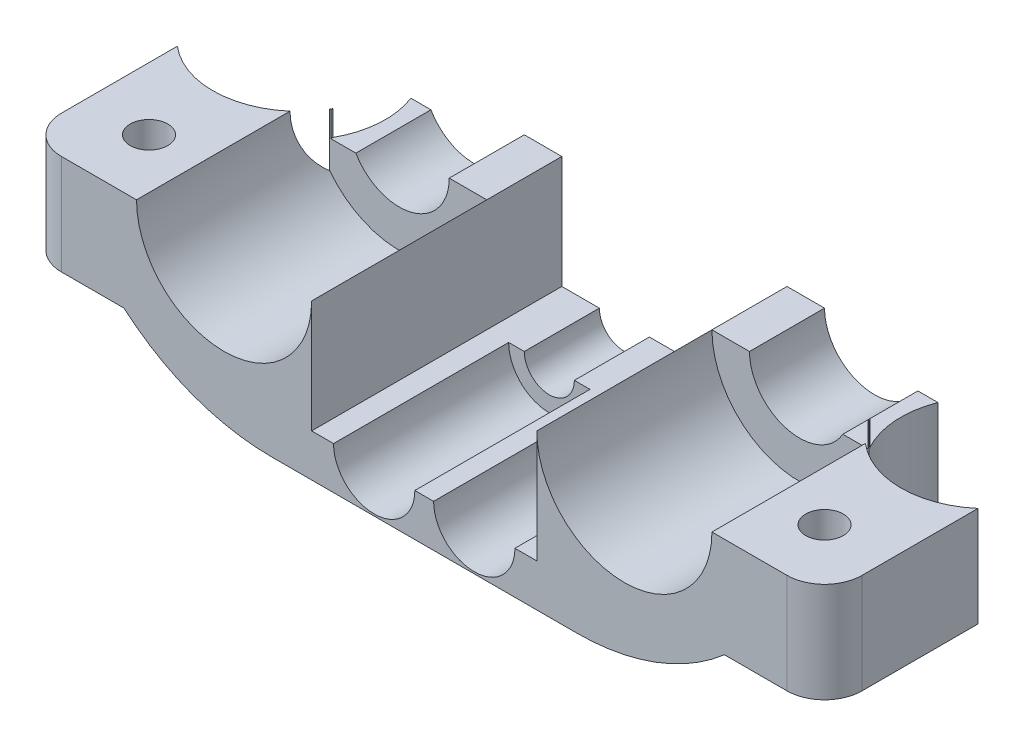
SolidWorks part; units mm, degrees
ref_plane "Plan1" through (0, 0, 0) normal (0, 0, 1) x (1, 0, 0)
ref_plane "Plan2" through (0, 0, 0) normal (0, 1, 0) x (1, 0, 0)
ref_plane "Plan3" through (0, 0, 0) normal (1, 0, 0) x (0, 0, -1)
sketch "Esquisse1" plane through (0, 0, 0) normal (0, 0, 1) x (1, 0, 0)
  line L0 (-32, 12.4) -> (-21.4641, 12.4)
  line L1 (32, 12.4) -> (32, 4.4)
  line L2 (32, 4.4) -> (24, 4.4)
  line L3 (-12.2085, 0) -> (12.2085, 0)
  line L4 (-24, 4.4) -> (-32, 4.4)
  line L5 (-32, 4.4) -> (-32, 12.4)
  line L6 (-9, 12.4) -> (-9, 3.4)
  line L7 (-9, 3.4) -> (-6, 3.4)
  line L8 (9, 3.4) -> (9, 12.4)
  line L9 (9, 12.4) -> (12, 12.4)
  line L10 (-12, 12.4) -> (-9, 12.4)
  line L11 (21.4641, 12.4) -> (32, 12.4)
  line L12 (-2, 3.4) -> (2, 3.4)
  line L13 (6, 3.4) -> (9, 3.4)
  line L14 (-19.4641, 10.4) -> (-21.4641, 10.4)
  line L15 (-21.4641, 10.4) -> (-21.4641, 12.4)
  line L16 (19.4641, 10.4) -> (21.4641, 10.4)
  line L17 (21.4641, 10.4) -> (21.4641, 12.4)
  arc A0 (12.2085, 0) -> (24, 4.4) centre (12.2085, 18) ccw
  arc A1 (-12.2085, 0) -> (-24, 4.4) centre (-12.2085, 18) cw
  arc A2 (-19.4641, 10.4) -> (-12, 12.4) centre (-16, 12.4) ccw
  arc A3 (12, 12.4) -> (19.4641, 10.4) centre (16, 12.4) ccw
  arc A4 (-6, 3.4) -> (-2, 3.4) centre (-4, 3.4) ccw
  arc A5 (2, 3.4) -> (6, 3.4) centre (4, 3.4) ccw
  dimension "D3" = 2
  dimension "D4" = 4
  dimension "D14" = 18
  dimension "D1" = 8
  dimension "D2" = 12.4
  dimension "D5" = 8
  dimension "D6" = 18
  dimension "D7" = 8
  dimension "D8" = 5
  dimension "D9" = 64
  dimension "D10" = 23
  dimension "D11" = 2
  dimension "D12" = 32
  dimension "D13" = 16
  dimension "D15" = 2
extrude "Base-Extrusion" add sketch "Esquisse1" along normal blind 20
sketch "Esquisse2" plane through (0, 4.4, 0) normal (0, -1, 0) x (1, 0, 0)
  line L0 (24, 20) -> (32, 20) construction
  line L1 (24, 20) -> (12.2085, 20) construction
  circle A0 centre (-27.5, 2.5) radius 6.9
  circle A1 centre (27.5, 2.5) radius 6.9
  circle A2 centre (27, 15) radius 1.5
  circle A3 centre (-27, 15) radius 1.5
  dimension "D1" = 3
  dimension "D2" = 13.8
  dimension "D3" = 54
  dimension "D4" = 27
  dimension "D5" = 5
  dimension "D6" = 55
  dimension "D7" = 27.5
  dimension "D8" = 17.5
extrude "Enlèv. mat.-Extru.1" cut sketch "Esquisse2" against normal mid plane 20
sketch "Esquisse3" plane through (0, 4.4, 0) normal (0, -1, 0) x (1, 0, 0)
  circle A0 centre (-27, 15) radius 3.5
  circle A1 centre (27, 15) radius 3.5
  dimension "D1" = 7
extrude "Enlèv. mat.-Extru.2" cut sketch "Esquisse3" against normal blind 3
sketch "Esquisse4" plane through (0, 0, 20) normal (0, 0, 1) x (1, 0, 0)
  circle A0 centre (-16, 12.4) radius 7
  circle A1 centre (16, 12.4) radius 7
  circle A2 centre (-4, 3.4) radius 3.25
  circle A3 centre (4, 3.4) radius 3.25
  dimension "D1" = 14
  dimension "D2" = 6.5
extrude "Enlèv. mat.-Extru.3" cut sketch "Esquisse4" against normal blind 14
fillet "Congé1" radius 3
